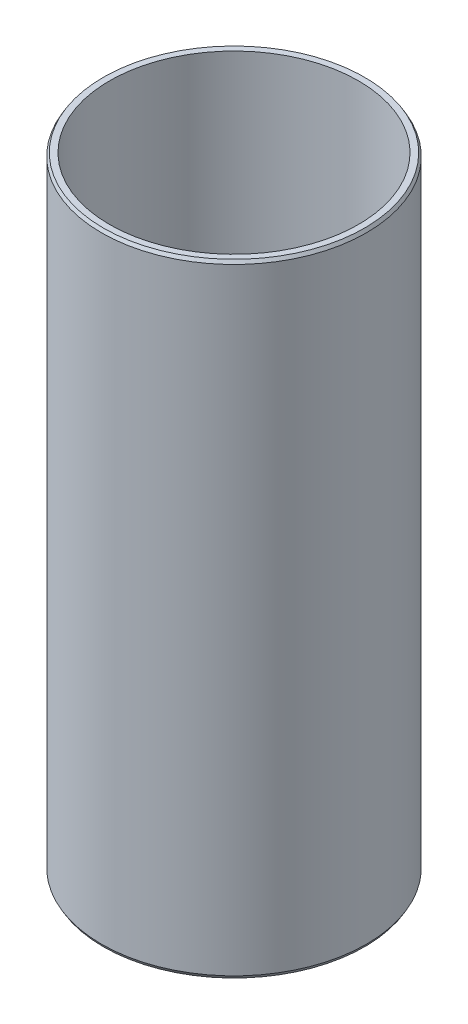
SolidWorks part; units mm, degrees
ref_plane "Plan de face" through (0, 0, 0) normal (0, 0, 1) x (1, 0, 0)
ref_plane "Plan de dessus" through (0, 0, 0) normal (0, 1, 0) x (1, 0, 0)
ref_plane "Plan de droite" through (0, 0, 0) normal (1, 0, 0) x (0, 0, -1)
sketch "Esquisse1" plane through (0, 0, 0) normal (0, 1, 0) x (1, 0, 0)
  circle A0 centre (0, 0) radius 41.5
  circle A1 centre (0, 0) radius 39
  dimension "D1" = 83
  dimension "D2" = 78
extrude "Extrusion1" add sketch "Esquisse1" along normal blind 195
chamfer "Chanfrein1" distance 1 angle 30 2 edges at (0, 0, 41.5) (0, 195, 41.5)
